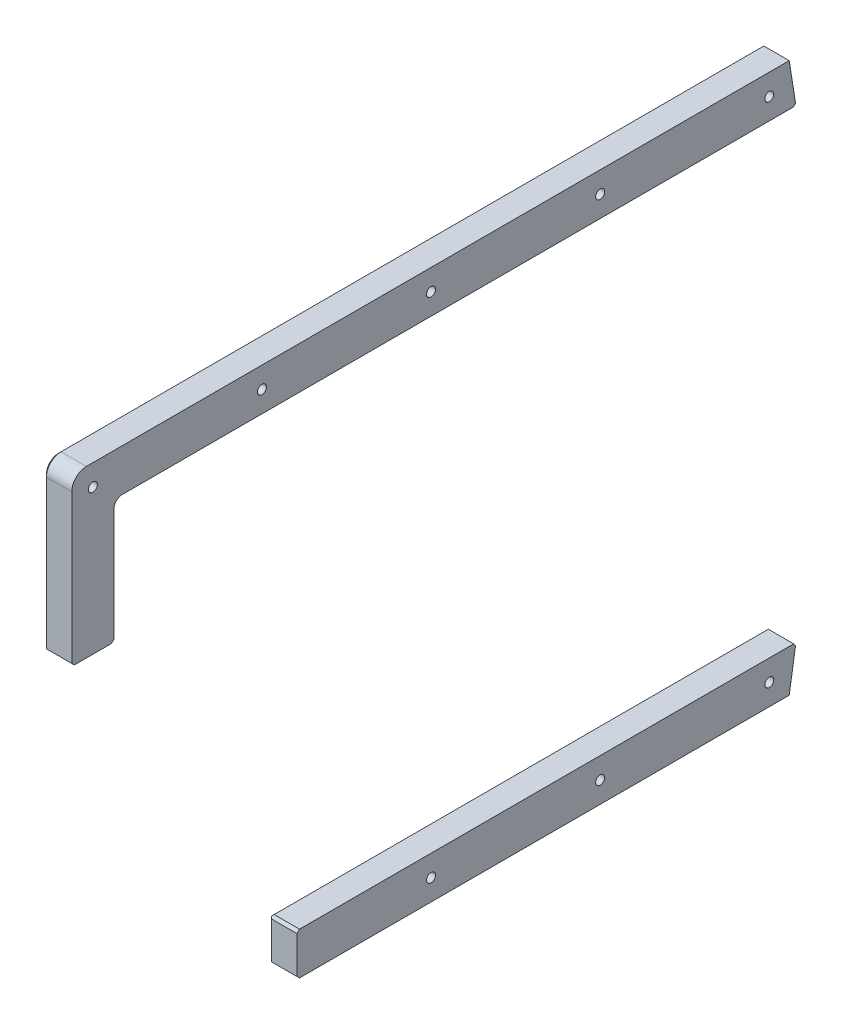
SolidWorks part; units mm, degrees
ref_plane "Front Plane" through (0, 0, 0) normal (0, 0, 1) x (1, 0, 0)
ref_plane "Top Plane" through (0, 0, 0) normal (0, 1, 0) x (1, 0, 0)
ref_plane "Right Plane" through (0, 0, 0) normal (1, 0, 0) x (0, 0, -1)
sketch "Sketch1" plane through (0, 0, 0) normal (1, 0, 0) x (0, 0, -1)
  line L0 (-5.4557, 103.2551) -> (-5.4557, -53.0565)
  line L1 (-1.0615, -57.4507) -> (210.0633, -57.4507)
  line L2 (210.0633, -57.4507) -> (212.0757, -44.7507)
  line L3 (212.0757, -44.7507) -> (7.2189, -44.7507)
  line L4 (7.2189, -44.7507) -> (7.2189, 94.9493)
  line L5 (210.0633, 107.6493) -> (-1.0615, 107.6493)
  line L6 (0.8689, -0.3007) -> (7.2189, -0.3007) construction
  line L7 (210.0633, -57.4507) -> (223.1443, 25.0993) construction
  line L8 (210.0633, 107.6493) -> (-1.0615, 107.6493) construction
  line L9 (-1.0615, -57.4507) -> (210.0633, -57.4507) construction
  line L10 (7.2189, 94.9493) -> (212.0757, 94.9493)
  line L11 (7.2189, 94.9493) -> (7.2189, 107.6493) construction
  line L12 (212.0757, 94.9493) -> (210.0633, 107.6493)
  line L13 (223.1443, 25.0993) -> (210.0633, 107.6493) construction
  line L14 (102.4689, -51.1007) -> (102.4689, -44.7507) construction
  line L15 (51.6689, -44.7507) -> (51.6689, -57.4507) construction
  circle A0 centre (102.4689, -51.1007) radius 1.3525
  arc A1 (-5.4557, -53.0565) -> (-1.0615, -57.4507) centre (-1.0615, -53.0565) ccw construction
  arc A3 (-5.4557, 103.2551) -> (-1.0615, 107.6493) centre (-1.0615, 103.2551) cw
  arc A4 (-1.0615, 107.6493) -> (-5.4557, 103.2551) centre (-1.0615, 103.2551) ccw construction
  arc A6 (-5.4557, -53.0565) -> (-1.0615, -57.4507) centre (-1.0615, -53.0565) ccw
  circle A9 centre (153.2689, -51.1007) radius 1.3526
  circle A10 centre (51.6689, -51.1007) radius 1.3526
  circle A11 centre (0.8689, -51.1007) radius 1.3526
  circle A12 centre (0.8689, -0.3007) radius 1.3526
  circle A13 centre (0.8689, 50.4993) radius 1.3526
  circle A14 centre (204.0689, -51.1007) radius 1.3526
  circle A18 centre (0.8689, 101.2993) radius 1.3526
  circle A19 centre (51.6689, 101.2993) radius 1.3526
  circle A20 centre (102.4689, 101.2993) radius 1.3526
  circle A21 centre (153.2689, 101.2993) radius 1.3526
  circle A22 centre (204.0689, 101.2993) radius 1.3526
  circle A30 centre (153.2689, -51.1007) radius 1.8923 construction
  circle A31 centre (102.4689, -51.1007) radius 1.8923 construction
  circle A32 centre (51.6689, -51.1007) radius 1.8923 construction
  circle A33 centre (0.8689, -51.1007) radius 1.8923 construction
  circle A34 centre (0.8689, -0.3007) radius 1.8923 construction
  circle A35 centre (0.8689, 50.4993) radius 1.8923 construction
  point P8 (51.6689, -51.1007)
  point P43 (-1.0615, -53.0565)
  dimension "D1" = 2.7051
extrude "Boss-Extrude1" add sketch "Sketch1" along normal blind 8.382
fillet "Fillet1" radius 2.54 2 edges at (4.191, 94.9493, -7.2189) (4.191, -44.7507, -7.2189)
sketch "Sketch2" plane through (0, 0, 5.4557) normal (0, 0, 1) x (1, 0, 0)
  line L0 (8.382, 103.2551) -> (8.382, -53.0565) construction
  line L1 (8.382, 32.1542) -> (4.1783, 32.1542)
  line L2 (8.382, 32.1542) -> (8.382, 18.0445)
  line L3 (8.382, 18.0445) -> (4.1783, 18.0445)
  line L4 (4.1783, 32.1542) -> (4.1783, 18.0445)
  line L5 (14.7066, 29.6142) -> (6.7183, 29.6142) construction
  line L6 (6.7183, 20.5845) -> (14.7066, 20.5845) construction
  line L7 (6.7183, 29.6142) -> (6.7183, 20.5845) construction
  dimension "D1" = 2.54
  dimension "D2" = 2.54
  dimension "D3" = 2.54
extrude "Cut-Extrude1" cut sketch "Sketch2" against normal offset from surface (10.9746 mm away) 1.7
chamfer "Chamfer1" distance 0.762 angle 45 14 edges at (4.191, 94.9493, -212.0757) (0, 101.2993, -211.0695) (4.191, -44.7507, -212.0757) (0, 94.9493, -110.9173) (0, 107.6493, -104.5009) (0, 94.2054, -7.9628) (0, 106.3623, 4.1687) (0, 25.0993, -7.2189) (0, 25.0993, 5.4557) (0, -44.0067, -7.9628) (0, -56.1636, 4.1687) (0, -44.7507, -110.9173) (0, -51.1007, -211.0695) (0, -57.4507, -104.5009)
sketch "Sketch3" plane through (0, 0, 0) normal (-1, 0, 0) x (0, 0, 1)
  line L0 (-62.1769, -44.7507) -> (-62.1769, -57.4507)
  line L1 (-211.4098, -44.7507) -> (-9.7589, -44.7507) construction
  line L2 (1.0615, -57.4507) -> (-210.0633, -57.4507) construction
  line L3 (5.4557, 57.8073) -> (-7.2189, 57.8073)
  line L4 (5.4557, 103.2551) -> (5.4557, -53.0565) construction
  line L5 (-7.2189, -42.2107) -> (-7.2189, 92.4093) construction
  line L6 (173.6037, 57.2993) -> (-7.2189, 57.2993) construction
  line L8 (-62.1769, -57.4507) -> (5.4557, -57.4507)
  line L9 (5.4557, 57.8073) -> (5.4557, -57.4507)
  line L10 (-62.1769, -44.7507) -> (-7.2189, 57.2993)
  line L11 (-61.6689, -60.0387) -> (-61.6689, -45.0047) construction
  dimension "D1" = 0.508
  dimension "D2" = 0.508
extrude "Cut-Extrude2" cut sketch "Sketch3" against normal through all flip side to cut contours L3 L9 L8 L0 L10
chamfer "Chamfer2" distance 0.762 angle 45 3 edges at (0, 57.8073, -0.8816) (4.572, 57.8073, 5.4557) (4.572, 57.8073, -7.2189)
chamfer "Chamfer3" distance 0.762 angle 45 3 edges at (4.572, -44.7507, -62.1769) (0, -51.1007, -62.1769) (4.572, -57.4507, -62.1769)
